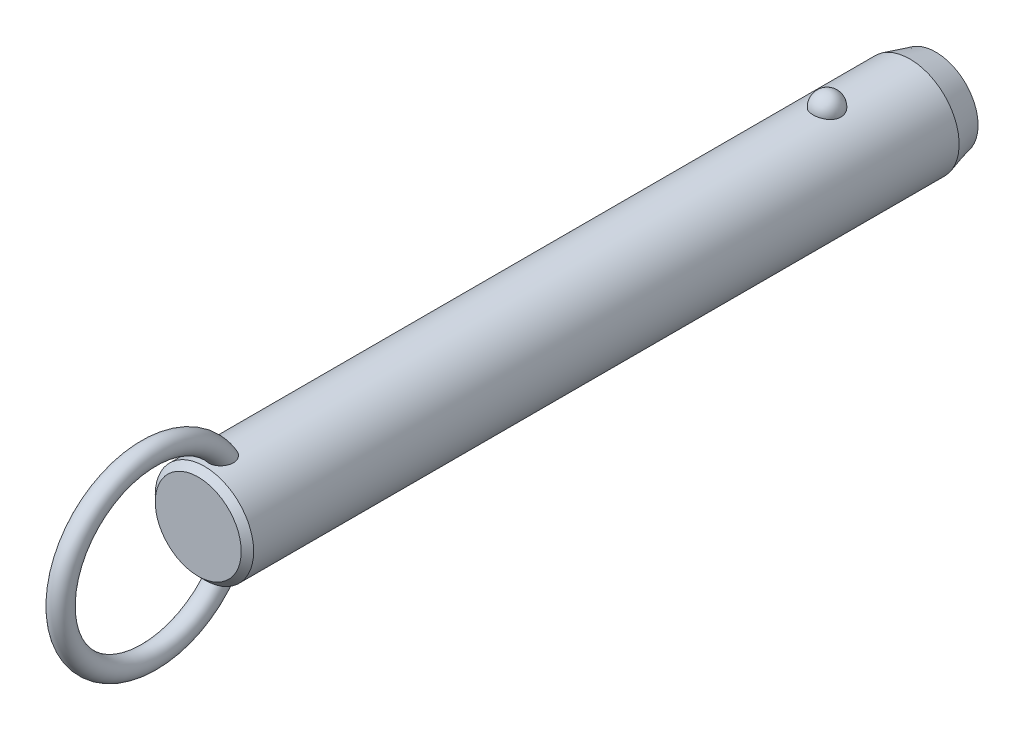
SolidWorks part; units mm, degrees
ref_plane "Front Plane" through (0, 0, 0) normal (0, 0, 1) x (1, 0, 0)
ref_plane "Top Plane" through (0, 0, 0) normal (0, 1, 0) x (1, 0, 0)
ref_plane "Right Plane" through (0, 0, 0) normal (1, 0, 0) x (0, 0, -1)
sketch "Sketch2" plane through (0, 0, 0) normal (0, 0, 1) x (1, 0, 0)
  circle A0 centre (0, 0) radius 9.5
  point P3 (0, 9.5)
  dimension "D1" = 19
extrude "Boss-Extrude1" add sketch "Sketch2" along normal blind 109.2
sketch "Sketch3" plane through (0, 0, 0) normal (0, 0, -1) x (-1, 0, 0)
  circle A0 centre (0, 0) radius 9.5
  dimension "D1" = 19
extrude "Boss-Extrude2" add sketch "Sketch3" along normal blind 23.7
chamfer "Chamfer1" distance 5 angle 15 1 edges at (-9.5, 0, -23.7)
sketch "Sketch12" plane through (0, 0, 0) normal (1, 0, 0) x (0, 0, -1)
  line L0 (-109.2, 9.5) -> (-109.2, -9.5) construction
  point P0 (-109.2, 0)
sketch "Sketch13" plane through (0, 0, 0) normal (1, 0, 0) x (0, 0, -1)
  circle A0 centre (-128.25, 0) radius 19.05
  point P2 (-109.2, 0)
  dimension "D1" = 38.1
sketch "Sketch14" plane through (0, 0, 0) normal (0, 1, 0) x (1, 0, 0)
  circle A0 centre (0, -111.2) radius 2
  point P2 (0, -109.2)
  dimension "D1" = 4
sweep "Sweep1" add profiles "Sketch14" path "Sketch13"
sketch "Sketch15" plane through (0, 0, 109.2) normal (0, 0, 1) x (1, 0, 0)
  circle A0 centre (0, 0) radius 9.5
  dimension "D1" = 19
extrude "Boss-Extrude3" add sketch "Sketch15" along normal blind 9.52
chamfer "Chamfer2" distance 1.2 angle 45 1 edges at (9.5, 0, 118.72)
sketch "Sketch18" plane through (0, 0, 0) normal (1, 0, 0) x (0, 0, -1)
  line L0 (18.7, 9.5) -> (-111.7378, 9.5) construction
  line L1 (2.7, 12.2) -> (2.7, 6.8)
  line L2 (-111.7378, -9.5) -> (18.7, -9.5) construction
  arc A0 (2.7, 12.2) -> (2.7, 6.8) centre (2.7, 9.5) ccw
  point P4 (0, 9.5)
  dimension "D1" = 21.7
revolve "Revolve1" add sketch "Sketch18" angle 360 about L1
